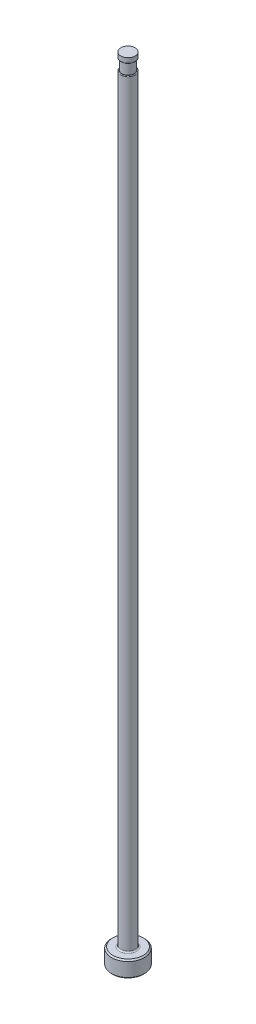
SolidWorks part; units mm, degrees
ref_plane "Front Plane" through (0, 0, 0) normal (0, 0, 1) x (1, 0, 0)
ref_plane "Top Plane" through (0, 0, 0) normal (0, 1, 0) x (1, 0, 0)
ref_plane "Right Plane" through (0, 0, 0) normal (1, 0, 0) x (0, 0, -1)
other "Configuration Table"
sketch "Sketch1" plane through (0, 0, 0) normal (0, 0, 1) x (1, 0, 0)
  line L0 (0, 259.9588) -> (0, -15.1925) construction
  line L1 (0, 0) -> (-3.175, 0)
  line L2 (-3.175, 0) -> (-3.175, 3.175)
  line L3 (-3.175, 3.175) -> (-1.3881, 3.175)
  line L4 (-1.3881, 3.175) -> (-1.3881, 152.4)
  line L5 (-1.3881, 152.4) -> (0, 152.4)
  line L6 (0, 152.4) -> (0, 0)
  dimension "L" = 152.4
  dimension "H" = 6.35
  dimension "T" = 3.175
  dimension "D" = 2.7762
revolve "Revolve1" add sketch "Sketch1" angle 360 about L0
chamfer "Chamfer1" distance 0.254 angle 45 2 edges at (0, 3.175, 3.175) (0, 0, 3.175)
fillet "Fillet1" radius 0.254 1 edges at (0, 3.175, 1.3881)
sketch "Sketch2" plane through (0, 0, 0) normal (0, 0, 1) x (1, 0, 0)
  line L0 (-1.3881, 152.4) -> (-1.3881, 3.429) construction
  line L1 (-1.3881, 151.384) -> (-1.1849, 151.384)
  line L2 (-1.3881, 151.384) -> (-1.3881, 149.352)
  line L3 (-1.3881, 149.352) -> (-1.1849, 149.352)
  line L4 (-1.1849, 151.384) -> (-1.1849, 149.352)
  line L5 (1.3881, 152.4) -> (-1.3881, 152.4) construction
  line L6 (0, 153.4483) -> (0, 147.3282) construction
  dimension "D1" = 2.032
  dimension "N" = 1.016
  dimension "FD" = 0.2032
  dimension "D3" = 2.3698
revolve "Vent Relief" cut sketch "Sketch2" angle 360 about L6
sketch "Sketch3" plane through (0, 0, 0) normal (0, 0, 1) x (1, 0, 0)
  line L0 (-1.1849, 150.368) -> (-1.1849, 86.868)
  line L1 (-1.1849, 151.384) -> (-1.1849, 149.352) construction
  line L2 (-1.3881, 149.352) -> (-1.3881, 3.429) construction
  line L3 (-1.3881, 85.7504) -> (-1.3881, 150.368)
  line L4 (-1.3881, 150.368) -> (-1.1849, 150.368)
  arc A0 (-1.1849, 86.868) -> (-1.3881, 85.7504) centre (-4.3599, 86.868) cw
  dimension "D1" = 3.175
  dimension "D2" = 63.5
extrude "D-Slot" cut sketch "Sketch3" against normal through all both and the other way through all
sketch "Sketch5" plane through (0, 0, 0) normal (0, 0, 1) x (1, 0, 0)
  line L0 (-1.3881, 151.384) -> (1.3881, 151.384) construction
  line L1 (-1.3881, 152.4) -> (-1.383, 152.4)
  line L2 (-1.3881, 152.4) -> (-1.3881, 151.384)
  line L3 (-1.3881, 151.384) -> (-1.383, 151.384)
  line L4 (-1.383, 152.4) -> (-1.383, 151.384)
  line L5 (0, 152.6877) -> (0, 150.5771) construction
  dimension "VP" = 0.0051
revolve "Vent Diameter" cut sketch "Sketch5" angle 360 about L5
fillet "Fillet2" radius 0.127 2 edges at (1.3881, 149.352, 0) (0, 151.384, 1.383)
sketch "Pocket Sketch" plane through (0, 0, 0) normal (0, 0, 1) x (1, 0, 0)
  line L0 (-3.5719, 0) -> (-3.5719, 3.2004)
  line L1 (-3.5719, 3.2004) -> (-2.3485, 3.2004)
  line L2 (-1.5865, 3.9624) -> (-1.5865, 22.225)
  line L3 (-1.5865, 22.225) -> (0, 22.225)
  line L4 (0, 22.225) -> (0, 0)
  line L5 (0, 0) -> (-3.5719, 0)
  line L6 (0, 12.6104) -> (0, -2.4989) construction
  line L7 (-3.175, 2.921) -> (-3.175, 0.254) construction
  line L8 (2.921, 3.175) -> (-2.921, 3.175) construction
  line L9 (-1.3881, 85.7504) -> (-1.3881, 3.429) construction
  line L10 (-2.3485, 3.2004) -> (-1.5865, 3.9624)
  point P3 (-1.5865, 3.2004)
  dimension "D1" = 7.1437
  dimension "D2" = 0.3969
  dimension "D3" = 0.0254
  dimension "D4" = 0.1984
  dimension "D5" = 3.1731
  dimension "D6" = 22.225
